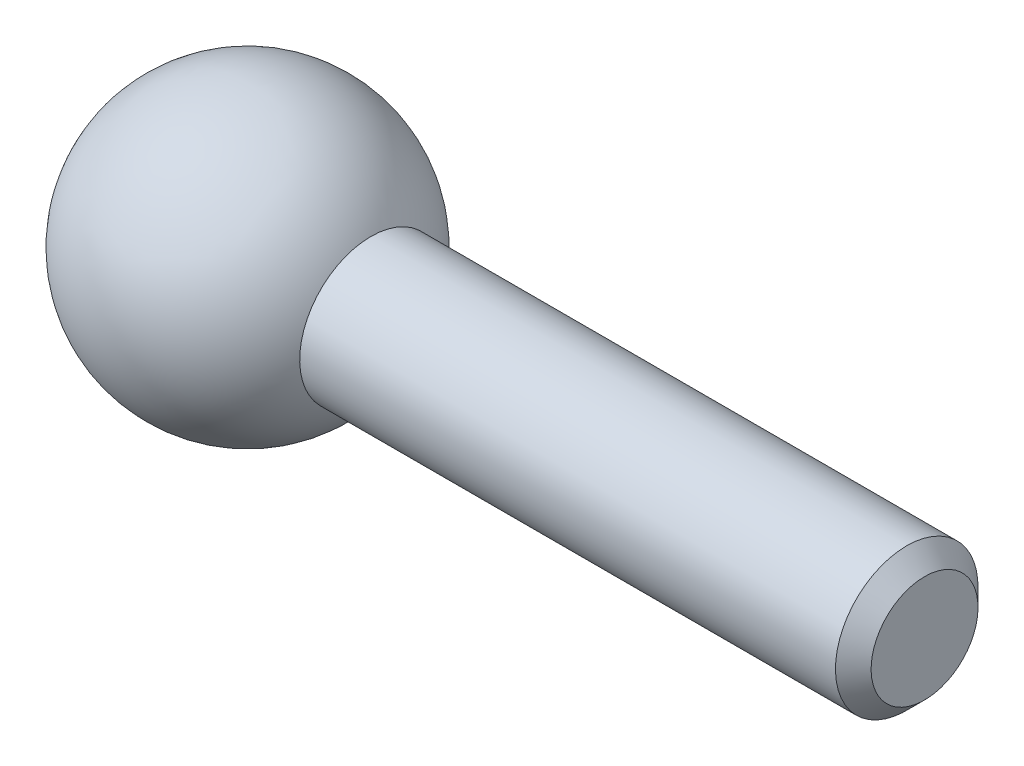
SolidWorks part; units mm, degrees
ref_plane "Plan1" through (0, 0, 0) normal (0, 0, 1) x (1, 0, 0)
ref_plane "Plan2" through (0, 0, 0) normal (0, 1, 0) x (1, 0, 0)
ref_plane "Plan3" through (0, 0, 0) normal (1, 0, 0) x (0, 0, -1)
sketch "Esquisse1" plane through (0, 0, 0) normal (0, 0, 1) x (1, 0, 0)
  line L0 (0, 0) -> (-12.3477, 0) construction
  line L1 (19, 0) -> (-4, 0)
  line L2 (19, 0) -> (19, 2)
  line L3 (19, 2) -> (3.4641, 2)
  arc A0 (3.4641, 2) -> (-4, 0) centre (0, 0) ccw
  dimension "D1" = 4
  dimension "D2" = 19
  dimension "D3" = 2
revolve "Base-Révolution" add sketch "Esquisse1" angle 360 about L0
chamfer "Chanfrein1" distance 0.5 angle 45
